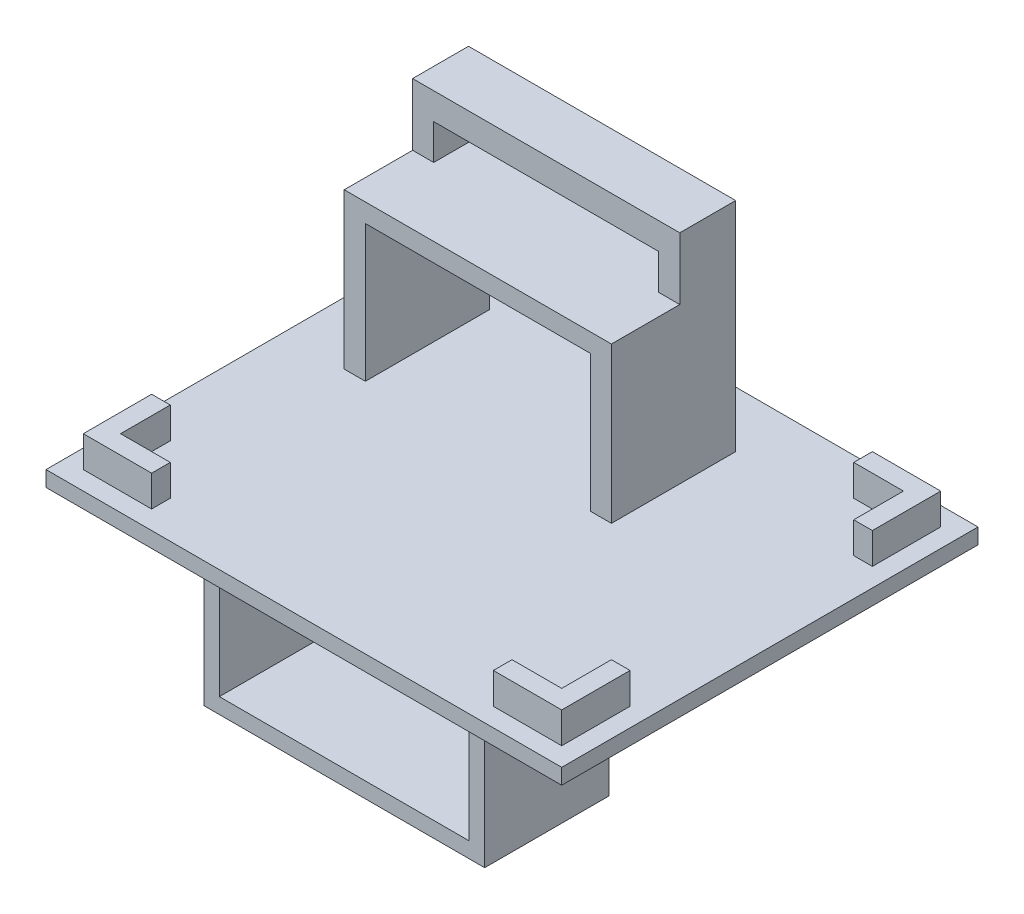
SolidWorks part; units mm, degrees
ref_plane "前视基准面" through (0, 0, 0) normal (0, 0, 1) x (1, 0, 0)
ref_plane "上视基准面" through (0, 0, 0) normal (0, 1, 0) x (1, 0, 0)
ref_plane "右视基准面" through (0, 0, 0) normal (1, 0, 0) x (0, 0, -1)
sketch "草图1" plane through (0, 0, 0) normal (0, 0, 1) x (1, 0, 0)
  line L0 (-22.6, 21.6) -> (22.6, 21.6)
  line L1 (-20.1, -19.1) -> (20.1, -19.1)
  line L2 (-20.1, -19.1) -> (-20.1, 19.1)
  line L3 (-20.1, 19.1) -> (20.1, 19.1)
  line L4 (20.1, -19.1) -> (20.1, 19.1)
  line L5 (-20.1, -19.1) -> (20.1, 19.1) construction
  line L6 (-20.1, 19.1) -> (20.1, -19.1) construction
  line L7 (22.6, -21.6) -> (22.6, 21.6)
  line L8 (-22.6, -21.6) -> (22.6, -21.6)
  line L9 (-22.6, -21.6) -> (-22.6, 21.6)
  point P0 (0, 0)
  dimension "D1" = 40.2
  dimension "D2" = 38.2
  dimension "D3" = 2.5
extrude "凸台-拉伸1" add sketch "草图1" along normal mid plane 20
sketch "草图4" plane through (0, 19.1, 0) normal (0, -1, 0) x (1, 0, 0)
  line L1 (-25, 33) -> (58, 33)
  line L2 (-25, 33) -> (-25, -34)
  line L3 (-25, -34) -> (58, -34)
  line L4 (58, 33) -> (58, -34)
  dimension "D1" = 58
  dimension "D2" = 25
  dimension "D3" = 33
  dimension "D4" = 34
extrude "凸台-拉伸3" add sketch "草图4" against normal up to surface (2.5 mm away)
sketch "草图5" plane through (0, 21.6, 0) normal (0, 1, 0) x (1, 0, 0)
  line L0 (6.5, 25) -> (6.5, 5) construction
  line L1 (-15, 25) -> (28, 25)
  line L2 (-15, 25) -> (-15, 5)
  line L3 (-15, 5) -> (28, 5)
  line L4 (28, 25) -> (28, 5)
  dimension "D1" = 5
  dimension "D2" = 20
  dimension "D3" = 6.5
  dimension "D4" = 43
extrude "凸台-拉伸4" add sketch "草图5" along normal blind 35
sketch "草图6" plane through (0, 0, -5) normal (0, 0, 1) x (1, 0, 0)
  line L0 (6.5, 56.6) -> (6.5, 23.1) construction
  line L1 (-15, 56.6) -> (28, 56.6) construction
  line L3 (-25, 21.6) -> (58, 21.6) construction
  line L4 (-11.6, 52.3) -> (24.6, 52.3)
  line L5 (-11.6, 52.3) -> (-11.6, 46.6)
  line L6 (-11.6, 46.6) -> (24.6, 46.6)
  line L7 (24.6, 52.3) -> (24.6, 46.6)
  point P4 (0, 0)
  dimension "D1" = 25
  dimension "D2" = 36.2
  dimension "D3" = 5.7
extrude "切除-拉伸1" cut sketch "草图6" against normal up to surface (20 mm away)
sketch "草图7" plane through (0, 21.6, 0) normal (0, 1, 0) x (1, 0, 0)
  line L14 (52, 28) -> (-19, 28)
  line L15 (-19, 28) -> (-19, -27)
  line L16 (-19, -27) -> (52, -27)
  line L17 (52, -27) -> (52, 28)
  line L18 (-22, -30) -> (55, -30)
  line L19 (55, -30) -> (55, 31)
  line L20 (55, 31) -> (-22, 31)
  line L21 (-22, 31) -> (-22, -30)
  line L22 (-22, -30) -> (55, -30)
  line L23 (55, -30) -> (55, 31)
  line L24 (55, 31) -> (-22, 31)
  line L25 (-22, 31) -> (-22, -30)
  dimension "D1" = 3
  dimension "D2" = 3
extrude "凸台-拉伸5" add sketch "草图7" along normal blind 5
sketch "草图13" plane through (0, 56.6, 0) normal (0, 1, 0) x (1, 0, 0)
  line L1 (-15, 25) -> (28, 25)
  line L2 (-15, 25) -> (-15, 19)
  line L3 (-15, 19) -> (28, 19)
  line L4 (28, 25) -> (28, 19)
  line L5 (28, 5) -> (28, 25) construction
  point P5 (15, 9)
  point P7 (-28, 15)
  dimension "D1" = 6
extrude "切除-拉伸4" [suppressed] cut sketch "草图13" against normal up to surface (10 mm away)
sketch "草图16" plane through (0, 0, -5) normal (0, 0, 1) x (1, 0, 0)
  line L0 (28, 56.6) -> (28, 21.6) construction
  line L1 (-15, 56.6) -> (28, 56.6)
  line L2 (-15, 56.6) -> (-15, 46.6)
  line L3 (-15, 46.6) -> (28, 46.6)
  line L4 (28, 56.6) -> (28, 46.6)
  line L5 (-11.6, 46.6) -> (24.6, 46.6) construction
extrude "切除-拉伸6" cut sketch "草图16" against normal blind 11
sketch "草图17" plane through (0, 0, -5) normal (0, 0, 1) x (1, 0, 0)
  line L0 (-25, 21.6) -> (58, 21.6) construction
  line L1 (-11.6, 43.6) -> (24.6, 43.6)
  line L2 (-11.6, 43.6) -> (-11.6, 21.6)
  line L3 (-11.6, 21.6) -> (24.6, 21.6)
  line L4 (24.6, 43.6) -> (24.6, 21.6)
  line L5 (24.6, 52.3) -> (24.6, 46.6) construction
  line L6 (-11.6, 46.6) -> (-11.6, 52.3) construction
  line L7 (-15, 46.6) -> (28, 46.6) construction
  dimension "D1" = 3
extrude "切除-拉伸7" cut sketch "草图17" against normal up to next
sketch "草图18" plane through (0, 26.6, 0) normal (0, 1, 0) x (1, 0, 0)
  line L0 (16.5, 31) -> (16.5, -30) construction
  line L1 (55, 31) -> (-22, 31) construction
  line L2 (-22, -30) -> (55, -30) construction
  line L3 (-22, 0.5) -> (55, 0.5) construction
  line L4 (-22, 31) -> (-22, -30) construction
  line L5 (55, -30) -> (55, 31) construction
  line L6 (52, -27) -> (52, 28) construction
  line L7 (52, 20) -> (55, 20)
  line L8 (52, 20) -> (52, -19)
  line L9 (52, -19) -> (55, -19)
  line L10 (55, 20) -> (55, -19)
  line L11 (55, -30) -> (55, 31) construction
  line L12 (-19, -27) -> (52, -27) construction
  line L13 (52, 28) -> (-19, 28) construction
  line L14 (-11, -27) -> (44, -27)
  line L15 (-11, -27) -> (-11, -30)
  line L16 (-11, -30) -> (44, -30)
  line L17 (44, -27) -> (44, -30)
  line L18 (-22, 20) -> (-22, -19)
  line L19 (-19, -19) -> (-22, -19)
  line L20 (-19, 20) -> (-19, -19)
  line L21 (-19, 20) -> (-22, 20)
  line L22 (44, 28) -> (44, 31)
  line L23 (-11, 31) -> (44, 31)
  line L24 (-11, 28) -> (-11, 31)
  line L25 (-11, 28) -> (44, 28)
  dimension "D1" = 8
  dimension "D2" = 8
extrude "切除-拉伸8" cut sketch "草图18" against normal up to surface (5 mm away)
sketch "草图19" plane through (0, 0, 0) normal (0, 0, 1) x (1, 0, 0)
  line L0 (22.6, 13.1) -> (28.6, 19.1)
  line L1 (22.6, -21.6) -> (22.6, 19.1) construction
  line L2 (58, 19.1) -> (-25, 19.1) construction
  line L3 (28.6, 19.1) -> (53, 19.1)
  line L4 (53, 19.1) -> (53, 16.1)
  line L5 (53, 16.1) -> (25.6, -11.3)
  line L6 (25.6, -11.3) -> (22.6, -11.3)
  line L7 (22.6, -11.3) -> (22.6, 13.1)
  line L8 (58, 21.6) -> (58, 19.1) construction
  dimension "D1" = 135
  dimension "D2" = 6
  dimension "D3" = 3
  dimension "D4" = 3
  dimension "D5" = 5
extrude "凸台-拉伸8" add sketch "草图19" along normal mid plane 4
sketch "草图21" plane through (0, 0, 2) normal (0, 0, 1) x (1, 0, 0)
  line L6 (25.6, 11.8574) -> (32.6711, 0.0137) construction
  line L7 (29.8426, 16.1) -> (41.6863, 9.0289) construction
  line L8 (25.6, -7.0574) -> (31.9418, -0.7156)
  line L9 (31.9418, -0.7156) -> (25.6, 9.9066)
  line L10 (25.6, 9.9066) -> (25.6, -7.0574)
  line L11 (26.3293, 12.5866) -> (29.1134, 15.3707)
  line L12 (25.6, 11.8574) -> (25.6, -7.0574)
  line L13 (25.6, -7.0574) -> (48.7574, 16.1)
  line L14 (48.7574, 16.1) -> (29.8426, 16.1)
  line L15 (29.8426, 16.1) -> (25.6, 11.8574)
  line L16 (25.6, 11.8574) -> (25.6, -7.0574) construction
  line L17 (25.6, -7.0574) -> (48.7574, 16.1) construction
  line L18 (48.7574, 16.1) -> (29.8426, 16.1) construction
  line L19 (29.8426, 16.1) -> (25.6, 11.8574) construction
  line L20 (29.1134, 15.3707) -> (40.957, 8.2997)
  line L21 (40.957, 8.2997) -> (33.4003, 0.743)
  line L22 (33.4003, 0.743) -> (26.3293, 12.5866)
  line L23 (48.7574, 16.1) -> (31.7934, 16.1)
  line L24 (31.7934, 16.1) -> (42.4156, 9.7582)
  line L25 (42.4156, 9.7582) -> (48.7574, 16.1)
  dimension "D2" = 10
  dimension "D3" = 10
  dimension "D4" = 1
  dimension "D5" = 1
  dimension "D6" = 1
  dimension "D7" = 1
  dimension "D1" = 3
extrude "切除-拉伸9" cut sketch "草图21" against normal up to surface (4 mm away)
fillet "圆角2" radius 0.8 10 edges at (48.7574, 16.1, 0) (31.7934, 16.1, 0) (42.4156, 9.7582, 0) (40.957, 8.2997, 0) (29.1134, 15.3707, 0) (26.3293, 12.5866, 0) (33.4003, 0.743, 0) (31.9418, -0.7156, 0) (25.6, -7.0574, 0) (25.6, 9.9066, 0)
